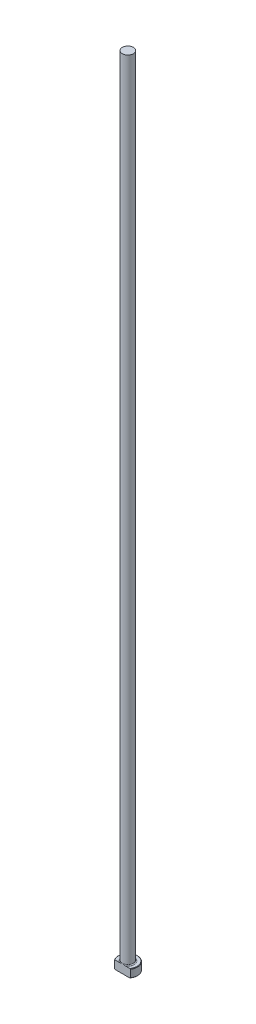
SolidWorks part; units mm, degrees
ref_plane "Front Plane" through (0, 0, 0) normal (0, 0, 1) x (1, 0, 0)
ref_plane "Top Plane" through (0, 0, 0) normal (0, 1, 0) x (1, 0, 0)
ref_plane "Right Plane" through (0, 0, 0) normal (1, 0, 0) x (0, 0, -1)
sketch "Sketch1" plane through (0, 0, 0) normal (0, 0, 1) x (1, 0, 0)
  line L0 (0, 259.9588) -> (0, -15.1925) construction
  line L1 (0, 0) -> (-5.5499, 0)
  line L2 (-5.5499, 0) -> (-5.5499, 4.7498)
  line L3 (-5.5499, 4.7498) -> (-3.175, 4.7498)
  line L4 (-3.175, 4.7498) -> (-3.175, 457.2)
  line L5 (-3.175, 457.2) -> (0, 457.2)
  line L6 (0, 457.2) -> (0, 0)
  dimension "L" = 457.2
  dimension "H" = 11.0998
  dimension "T" = 4.7498
  dimension "D" = 6.35
revolve "Revolve1" add sketch "Sketch1" angle 360 about L0
chamfer "Chamfer1" distance 0.254 angle 45 2 edges at (0, 4.7498, 5.5499) (0, 0, 5.5499)
fillet "Fillet1" radius 0.508 1 edges at (0, 4.7498, 3.175)
sketch "Sketch2" plane through (0, 0, 0) normal (0, 1, 0) x (1, 0, 0)
  line L0 (-4.552, -3.175) -> (4.552, -3.175)
  circle A0 centre (0, 0) radius 5.5499 construction
  arc A1 (-4.552, -3.175) -> (4.552, -3.175) centre (0, 0) ccw
  circle A3 centre (0, 0) radius 3.175 construction
  dimension "D1" = 0
extrude "Key" cut sketch "Sketch2" along normal through all
sketch "Pocket Sketch" plane through (0, 0, 0) normal (0, 0, 1) x (1, 0, 0)
  line L0 (-5.9468, 0) -> (-5.9468, 4.7752)
  line L1 (-5.9468, 4.7752) -> (-4.3339, 4.7752)
  line L2 (-3.5719, 5.5372) -> (-3.5719, 22.225)
  line L3 (-3.5719, 22.225) -> (0, 22.225)
  line L4 (0, 22.225) -> (0, 0)
  line L5 (0, 0) -> (-5.9468, 0)
  line L6 (0, 12.6104) -> (0, -2.4989) construction
  line L7 (-5.5499, 4.4958) -> (-5.5499, 0.254) construction
  line L8 (5.2959, 4.7498) -> (-5.2959, 4.7498) construction
  line L9 (-3.175, 457.2) -> (-3.175, 5.2578) construction
  line L10 (-4.3339, 4.7752) -> (-3.5719, 5.5372)
  point P3 (-3.5719, 4.7752)
  dimension "D1" = 11.8935
  dimension "D2" = 0.3969
  dimension "D3" = 0.0254
  dimension "D4" = 0.3969
  dimension "D5" = 7.1437
  dimension "D6" = 22.225
